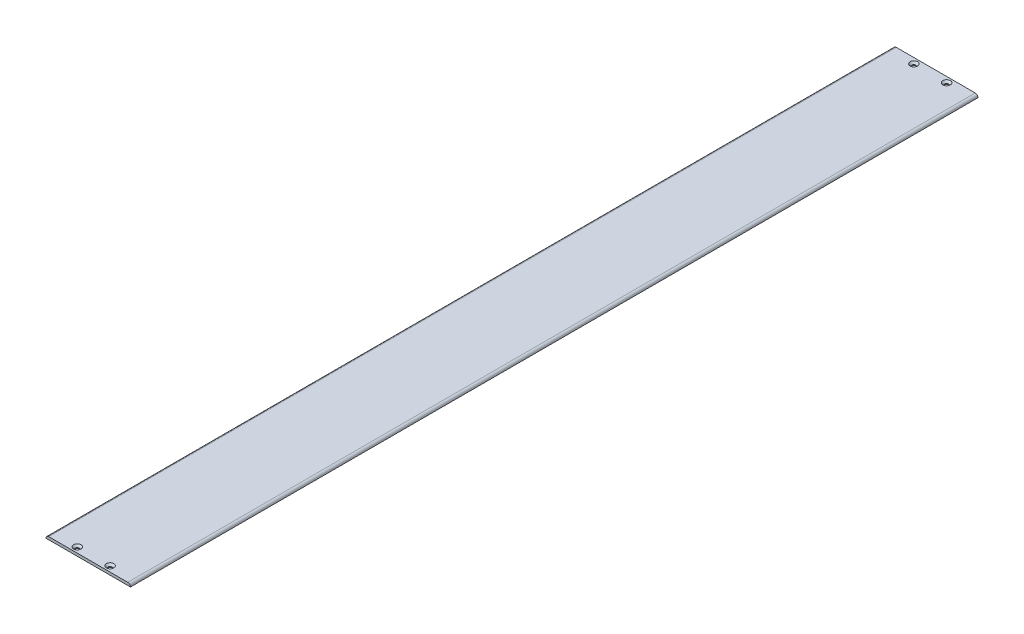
SolidWorks part; units mm, degrees
ref_plane "Front Plane" through (0, 0, 0) normal (0, 0, 1) x (1, 0, 0)
ref_plane "Top Plane" through (0, 0, 0) normal (0, 1, 0) x (1, 0, 0)
ref_plane "Right Plane" through (0, 0, 0) normal (1, 0, 0) x (0, 0, -1)
sketch "Sketch1" plane through (0, 0, 0) normal (0, 0, 1) x (1, 0, 0)
  line L1 (-31, 2) -> (31, 2)
  line L2 (-31, 2) -> (-31, 0)
  line L3 (-31, 0) -> (31, 0)
  line L4 (31, 2) -> (31, 0)
  dimension "D1" = 2
  dimension "D2" = 62
extrude "Extrude1" add sketch "Sketch1" along normal mid plane 622
fillet "Fillet1" radius 2 2 edges at (31, 2, 0) (-31, 2, 0)
sketch "Sketch2" plane through (0, 2, 0) normal (0, 1, 0) x (1, 0, 0)
  line L0 (-31, 311) -> (31, 311) construction
  line L1 (29, 311) -> (-29, 311) construction
  line L2 (29, -311) -> (-29, -311) construction
  line L3 (-31, -311) -> (-31, 311) construction
  point P0 (-12, -307)
  point P1 (12, -307)
  point P2 (12, 307)
  point P3 (-12, 307)
  point P4 (0, 311)
  point P9 (0, -311)
  dimension "D1" = 24
  dimension "D2" = 12
  dimension "D3" = 4
  dimension "D4" = 4
  dimension "D5" = 12
  dimension "D6" = 24
  dimension "D7" = 4
  dimension "D8" = 4
  dimension "D9" = 19
  dimension "D10" = 19
hole_wizard "CSK for M2.5 Flat Head Machine Screw1" positions "3DSketch1" profile "Sketch3" countersink size "M2.5" standard "ANSI Metric"
sketch3d "3DSketch1"
  point P0 (-12, 2, 307)
  point P3 (12, 2, 307)
  point P6 (12, 2, -307)
  point P9 (-12, 2, -307)
sketch "Sketch3" plane through (-12, 2, 307) normal (1, 0, 0) x (0, 0, 1)
  line L0 (0, 0) -> (0, 2)
  line L1 (0, 2) -> (1.35, 2)
  line L2 (1.35, 2) -> (1.35, 1.4)
  line L3 (1.35, 1.4) -> (2.75, 0)
  line L5 (2.75, 0) -> (0, 0)
  line L6 (-1.35, 1.4) -> (-2.75, 0) construction
  line L11 (0, -6.35) -> (0, 107.95) construction
  dimension "Thru Hole Dia." = 2.7
  dimension "Thru Hole Depth" = 2
  dimension "Near C'Sink Dia." = 5.5
  dimension "Near C'Sink Angle" = 90
